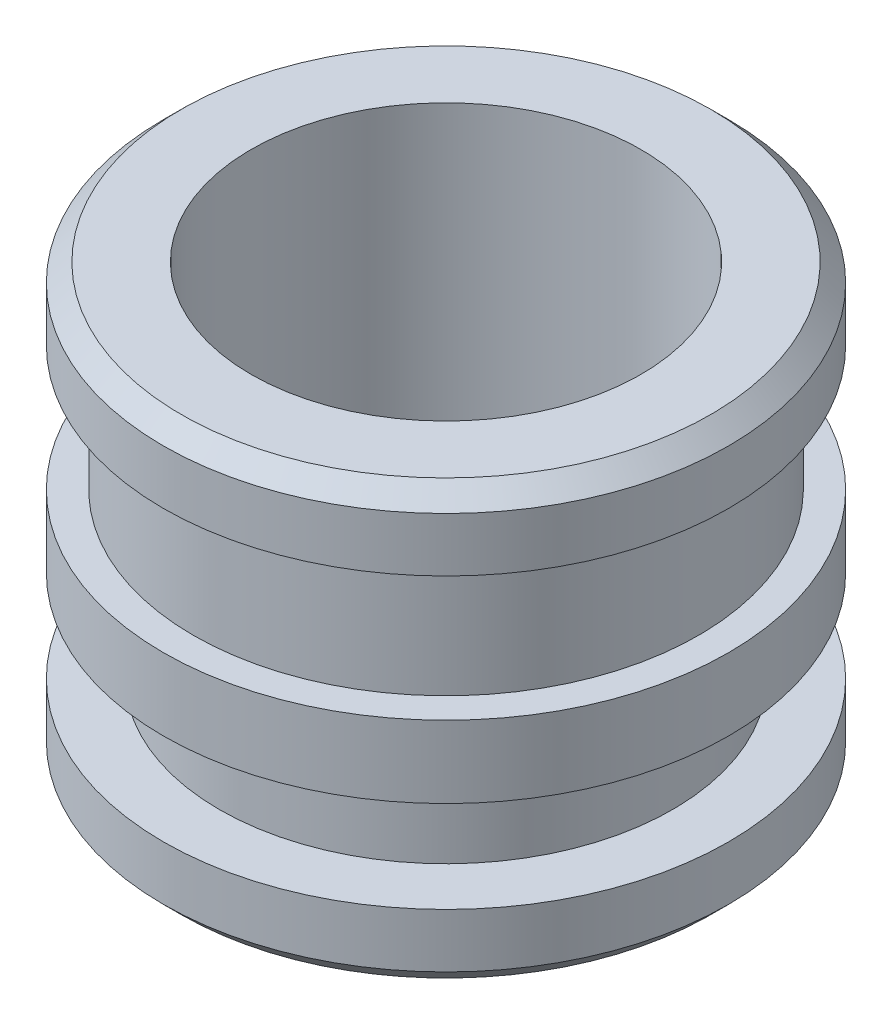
SolidWorks part; units mm, degrees
ref_plane "Front Plane" through (0, 0, 0) normal (0, 0, 1) x (1, 0, 0)
ref_plane "Top Plane" through (0, 0, 0) normal (0, 1, 0) x (1, 0, 0)
ref_plane "Right Plane" through (0, 0, 0) normal (1, 0, 0) x (0, 0, -1)
sketch "Sketch1" plane through (0, 0, 0) normal (0, 0, 1) x (1, 0, 0)
  line L0 (0, 11.0481) -> (0, -5.2098) construction
  line L1 (0, -55) -> (0, 55) construction
  line L2 (3.915, 2.27) -> (3.915, 3.27)
  line L3 (3.5, 5) -> (3.5, 3.27)
  line L4 (3.915, 0) -> (3.915, 1)
  line L5 (3.915, 1) -> (3.14, 1)
  line L6 (3.14, 1) -> (3.14, 2.27)
  line L7 (3.14, 2.27) -> (3.915, 2.27)
  line L8 (3.915, 6) -> (3.915, 5)
  line L9 (3.915, 6) -> (0, 6)
  line L11 (3.915, 5) -> (3.5, 5)
  line L13 (3.5, 3.27) -> (3.915, 3.27)
  line L14 (0, 6) -> (0, 0)
  line L19 (0, 0) -> (3.915, 0)
  dimension "D2" = 6
  dimension "D3" = 6.28
  dimension "D4" = 7.83
  dimension "D5" = 1
  dimension "D6" = 1.27
  dimension "D7" = 7.83
  dimension "D8" = 7.83
  dimension "D9" = 1
  dimension "D10" = 7
  dimension "D13" = 1
revolve "Revolve1" add sketch "Sketch1" angle 360 about L0
hole_wizard "M2.5x0.45 Tapped Hole1" positions "Sketch6" profile "Sketch5" tap size "M2.5x0.45" standard "ANSI Metric"
sketch "Sketch6" plane through (0, 6, 0) normal (0, 1, 0) x (1, 0, 0)
  point P0 (0, 0)
sketch "Sketch5" plane through (0, 6, 0) normal (1, 0, 0) x (0, 0, 1)
  line L0 (0, 0) -> (0, 4.8159)
  line L1 (0, 4.8159) -> (1.025, 4.2)
  line L2 (1.025, 4.2) -> (1.025, 0)
  line L5 (1.025, 0) -> (0, 0)
  line L10 (0, 4.8159) -> (-1.025, 4.2) construction
  line L11 (0, -6.35) -> (0, 107.95) construction
  dimension "Tap Drill Dia." = 2.05
  dimension "Tap Drill Depth" = 4.2
  dimension "Drill Angle" = 118
chamfer "Chamfer1" distance 0.25 angle 45
sketch "Sketch7" plane through (0, 6, 0) normal (0, 1, 0) x (1, 0, 0)
  circle A0 centre (0, 0) radius 2.7
  circle A1 centre (0, 0) radius 3.665 construction
  dimension "D1" = 5.4
extrude "Cut-Extrude1" cut sketch "Sketch7" against normal blind 4.5
